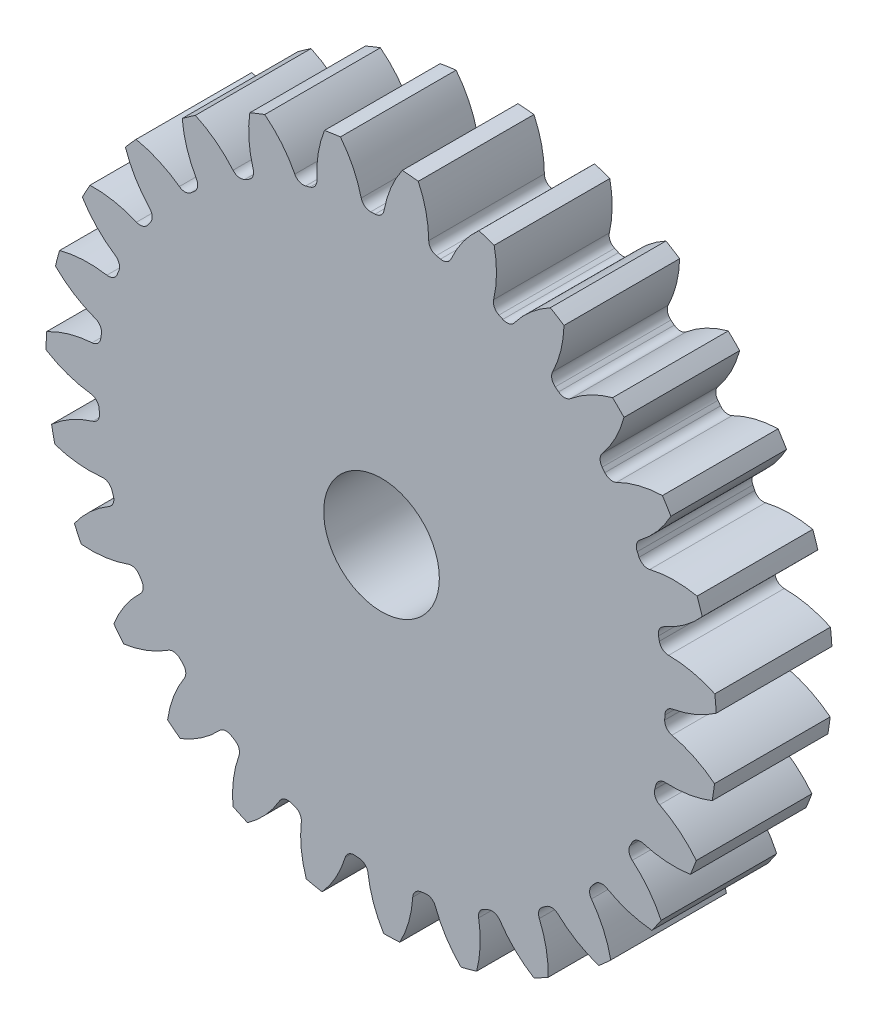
SolidWorks part; units mm, degrees
ref_plane "Front" through (0, 0, 0) normal (0, 0, 1) x (1, 0, 0)
ref_plane "Top" through (0, 0, 0) normal (0, 1, 0) x (1, 0, 0)
ref_plane "Right" through (0, 0, 0) normal (1, 0, 0) x (0, 0, -1)
sketch "Sketch3" plane through (0, 0, 0) normal (0, 0, 1) x (1, 0, 0)
  circle A0 centre (0, 0) radius 294.64
  dimension "od" = 589.28
extrude "gearBody" add sketch "Sketch3" along normal blind 101.6
sketch "Sketch2" plane through (0, 0, 0) normal (0, 0, 1) x (1, 0, 0)
  line L0 (0, 0) -> (238.1544, 98.6468) construction
  line L1 (293.1115, -35.7459) -> (0, 0) construction
  line L2 (0, 0) -> (36.3143, 0) construction
  line L3 (274.1939, 8.3165) -> (273.3141, -23.471) construction
  line L5 (273.754, -7.5773) -> (0, 0) construction
  line L7 (0, 0) -> (257.7765, 0) construction
  arc A0 (257.7542, 3.3879) -> (257.1722, -17.6406) centre (0, 0) ccw construction
  arc A1 (294.0241, 19.0415) -> (292.5206, -35.2766) centre (0, 0) ccw construction
  arc A2 (274.1939, 8.3165) -> (273.3141, -23.471) centre (0, 0) ccw construction
  arc A3 (248.765, -8.7838) -> (248.87, -4.9903) centre (0, 0) ccw
  arc A4 (293.1115, -35.7459) -> (255.0945, -17.1162) centre (232.333, -111.6695) ccw
  arc A5 (293.1115, -35.7459) -> (294.64, 19.4774) centre (0, 0) ccw
  arc A6 (294.64, 19.4774) -> (255.6507, 2.9792) centre (238.1544, 98.6468) cw
  arc A7 (248.87, -4.9903) -> (255.6507, 2.9792) centre (257.1386, -5.1561) cw
  arc A8 (255.0945, -17.1162) -> (248.765, -8.7838) centre (257.0301, -9.0756) cw
  point P6 (294.64, 19.4774)
  point P22 (293.1115, -35.7459)
  dimension "baseDia" = 515.553
  dimension "od" = 589.28
  dimension "pd" = 548.64
  dimension "rd" = 497.84
  dimension "rFillet" = 8.2702
  dimension "pointX" = 294.64
  dimension "pointY" = 19.4774
  dimension "CTT" = 31.7875
  dimension "flankCenterAngle" = 22.5
extrude "toothCut" cut sketch "Sketch2" along normal through all
pattern_circular "CirPattern1" count 27 over 360 about axis through (0, 0, 0) along (0, 0, 1) of "toothCut"
sketch "hub1Dia" plane through (0, 0, 0) normal (0, 0, -1) x (-1, 0, 0)
  circle A0 centre (0, 0) radius 12.7
  dimension "hub1Dia" = 25.4
sketch "hub2Dia" plane through (0, 0, 101.6) normal (0, 0, 1) x (1, 0, 0)
  circle A0 centre (0, 0) radius 12.7
  dimension "hub2dia" = 25.4
sketch "boreDia" plane through (0, 0, 0) normal (0, 0, 1) x (1, 0, 0)
  circle A0 centre (0, 0) radius 50.8
  dimension "boreDia" = 101.6
extrude "bore" cut sketch "boreDia" against normal mid plane 25400
